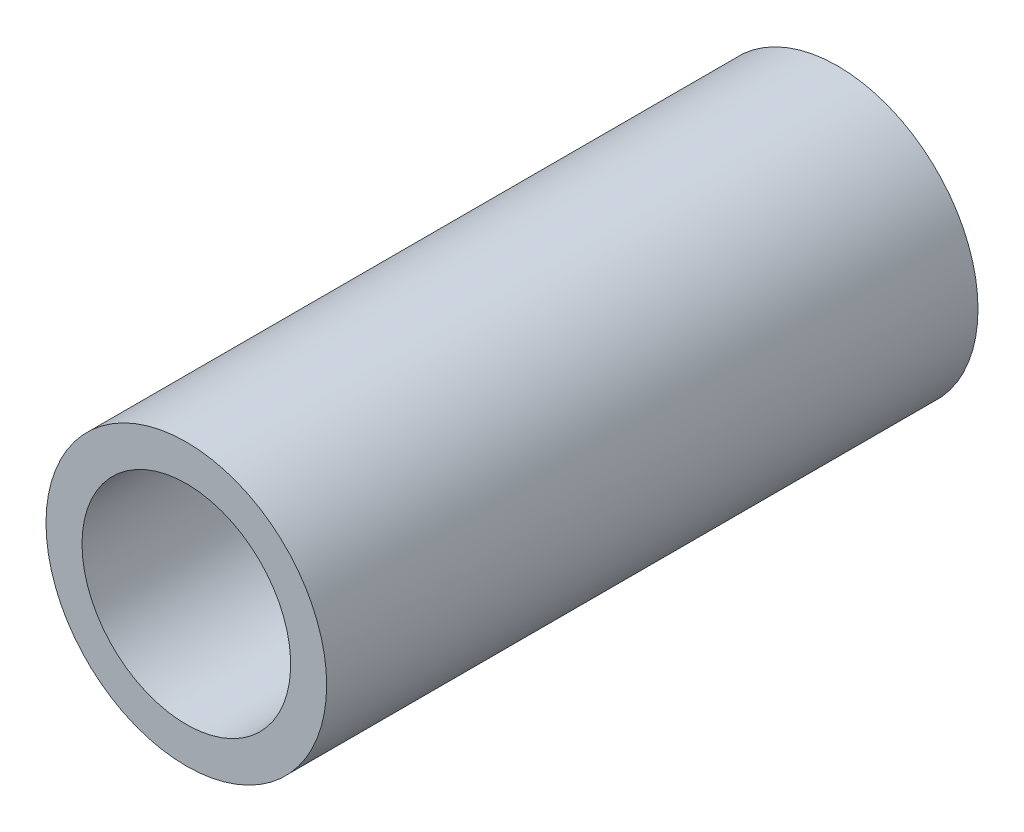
SolidWorks part; units mm, degrees
ref_plane "Front Plane" through (0, 0, 0) normal (0, 0, 1) x (1, 0, 0)
ref_plane "Top Plane" through (0, 0, 0) normal (0, 1, 0) x (1, 0, 0)
ref_plane "Right Plane" through (0, 0, 0) normal (1, 0, 0) x (0, 0, -1)
sketch "Sketch1" plane through (0, 0, 0) normal (0, 0, 1) x (1, 0, 0)
  circle A0 centre (0, 0) radius 5.0038
  circle A1 centre (0, 0) radius 6.731
  dimension "D1" = 13.462
  dimension "D2" = 10.0076
extrude "Boss-Extrude1" add sketch "Sketch1" along normal blind 31.242
